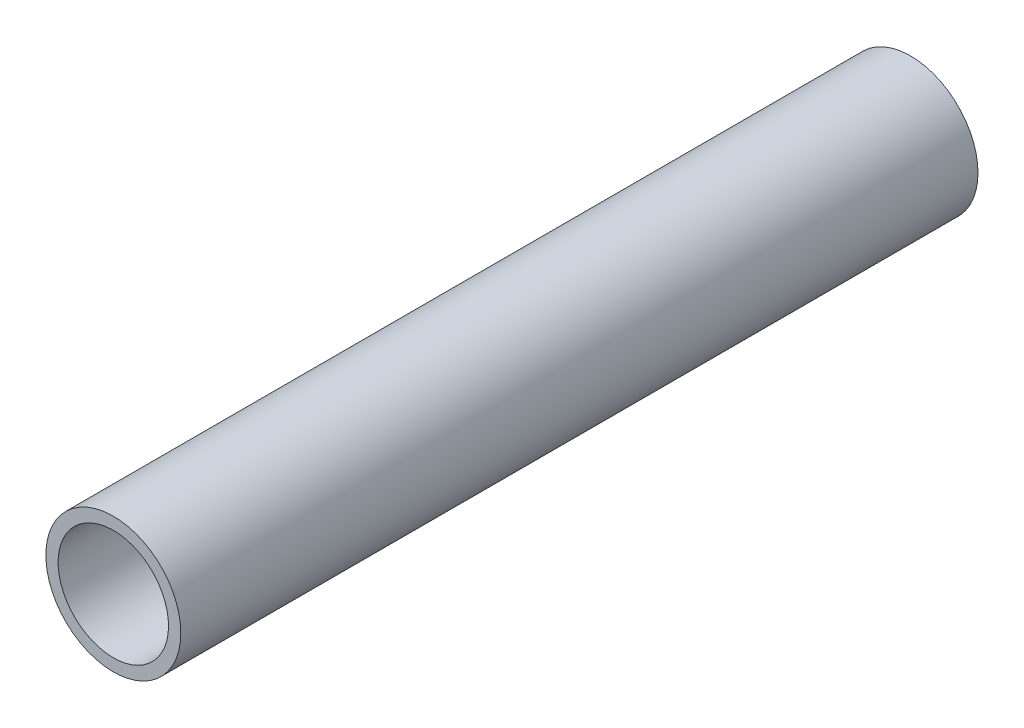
SolidWorks part; units mm, degrees
ref_plane "Alzado" through (0, 0, 0) normal (0, 0, 1) x (1, 0, 0)
ref_plane "Planta" through (0, 0, 0) normal (0, 1, 0) x (1, 0, 0)
ref_plane "Vista lateral" through (0, 0, 0) normal (1, 0, 0) x (0, 0, -1)
sketch "Croquis1" plane through (0, 0, 0) normal (0, 0, 1) x (1, 0, 0)
  circle A0 centre (0, 0) radius 9
  circle A1 centre (0, 0) radius 11
  dimension "D1" = 18
  dimension "D2" = 22
extrude "Saliente-Extruir1" add sketch "Croquis1" along normal blind 130
